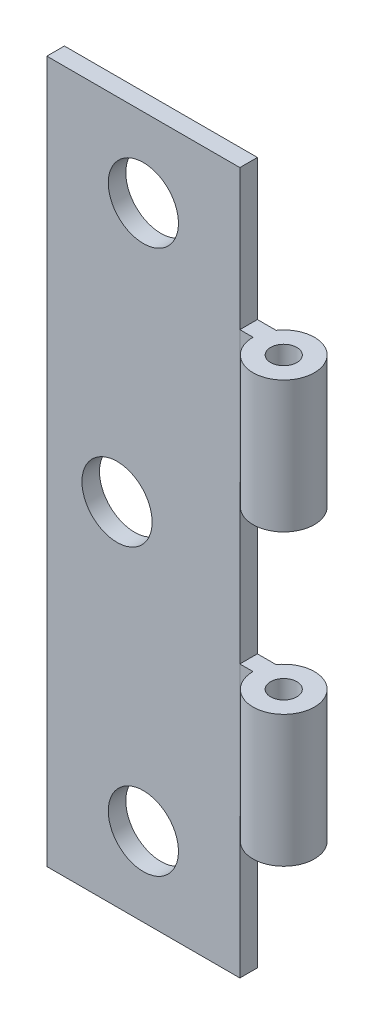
SolidWorks part; units mm, degrees
ref_plane "Front Plane" through (0, 0, 0) normal (0, 0, 1) x (1, 0, 0)
ref_plane "Top Plane" through (0, 0, 0) normal (0, 1, 0) x (1, 0, 0)
ref_plane "Right Plane" through (0, 0, 0) normal (1, 0, 0) x (0, 0, -1)
sketch "Sketch1" plane through (0, 0, 0) normal (0, 0, 1) x (1, 0, 0)
  line L1 (-8.7312, -31.75) -> (8.7313, -31.75)
  line L2 (-8.7312, -31.75) -> (-8.7312, 31.75)
  line L3 (-8.7312, 31.75) -> (8.7313, 31.75)
  line L4 (8.7313, -31.75) -> (8.7313, 31.75)
  line L5 (-8.7312, -31.75) -> (8.7313, 31.75) construction
  line L6 (-8.7312, 31.75) -> (8.7313, -31.75) construction
  point P0 (0, 0)
  dimension "D1" = 17.4625
  dimension "D2" = 63.5
extrude "Boss-Extrude1" add sketch "Sketch1" against normal blind 1.5875
sketch "Sketch3" plane through (0, 31.75, 0) normal (0, 1, 0) x (1, 0, 0)
  line L1 (8.7313, 0.7937) -> (24.4766, 0.7937) construction
  line L2 (8.7313, 0) -> (-8.7312, 0) construction
  line L4 (8.7313, 1.5875) -> (10.4201, 1.5875)
  line L5 (8.7313, 1.5875) -> (8.7313, 0)
  line L6 (8.7313, 0) -> (10.4201, 0)
  line L7 (10.4201, 1.5875) -> (10.4201, 0)
  circle A0 centre (12.7, 0) radius 1.1906
  circle A1 centre (12.7, 0) radius 2.7781
  point P1 (0, 0)
  point P2 (0, 0)
  point P7 (0, 0)
  dimension "D1" = 2.3813
  dimension "D2" = 5.5562
  dimension "D3" = 3.9688
extrude "Boss-Extrude2" add sketch "Sketch3" against normal up to surface (63.5 mm away) separate body contours L7 L1 A0 A1 L4 | L1 L7 A1 A0
sketch "Sketch4" plane through (0, 0, -1.5875) normal (0, 0, -1) x (-1, 0, 0)
  line L0 (2.3812, 31.75) -> (2.3813, -31.75) construction
  line L1 (-8.7313, 31.75) -> (8.7312, 31.75) construction
  line L2 (8.7312, -31.75) -> (-8.7313, -31.75) construction
  line L3 (0, -31.75) -> (0, 31.75) construction
  line L4 (8.7312, 31.75) -> (8.7312, -31.75) construction
  circle A0 centre (0, 24.6062) radius 3.175
  circle A1 centre (2.3812, 0) radius 3.175
  circle A2 centre (0, -24.6063) radius 3.175
  dimension "D1" = 6.35
  dimension "D2" = 6.35
  dimension "D3" = 8.7312
  dimension "D4" = 7.1437
  dimension "D5" = 7.1437
extrude "Cut-Extrude1" cut sketch "Sketch4" against normal through all
sketch "Sketch5" plane through (0, 0, -1.5875) normal (0, 0, -1) x (-1, 0, 0)
  line L0 (-8.7313, -31.75) -> (-8.7313, 31.75) construction
  line L1 (-8.7313, 19.05) -> (-15.4781, 19.05)
  line L2 (-8.7313, 19.05) -> (-8.7313, 7.1437)
  line L3 (-8.7313, 7.1437) -> (-15.4781, 7.1437)
  line L4 (-15.4781, 19.05) -> (-15.4781, 7.1437)
  line L5 (-15.4781, 31.75) -> (-15.4781, -31.75) construction
  line L6 (-8.7313, -31.75) -> (-8.7313, 31.75) construction
  line L7 (-8.7313, -7.1438) -> (-15.4781, -7.1438)
  line L8 (-8.7313, -7.1438) -> (-8.7313, -19.05)
  line L9 (-8.7313, -19.05) -> (-15.4781, -19.05)
  line L10 (-15.4781, -7.1438) -> (-15.4781, -19.05)
  line L11 (-15.4781, 19.8437) -> (-15.4781, 19.05)
  line L12 (-8.7313, 31.75) -> (-15.4781, 31.75)
  line L13 (-8.7313, 31.75) -> (-8.7313, 19.8437)
  line L14 (-8.7313, 19.8437) -> (-15.4781, 19.8437)
  line L15 (-15.4781, 31.75) -> (-15.4781, 19.8437)
  line L16 (-15.4781, 5.5562) -> (-8.7313, 5.5562)
  line L17 (-15.4781, 5.5562) -> (-15.4781, -6.35)
  line L18 (-15.4781, -6.35) -> (-8.7313, -6.35)
  line L19 (-8.7313, 5.5562) -> (-8.7313, -6.35)
  line L20 (-8.7313, -19.8438) -> (-15.4781, -19.8438)
  line L21 (-8.7313, -19.8438) -> (-8.7313, -31.75)
  line L22 (-8.7313, -31.75) -> (-15.4781, -31.75)
  line L23 (-15.4781, -19.8438) -> (-15.4781, -31.75)
  line L24 (-8.7313, 19.05) -> (-8.7313, 19.8437)
  line L25 (-8.7313, 7.1437) -> (-8.7313, 5.5562)
  line L26 (-15.4781, 5.5562) -> (-15.4781, 7.1437)
  line L27 (-15.4781, -6.35) -> (-15.4781, -7.1438)
  line L28 (-8.7313, -7.1438) -> (-8.7313, -6.35)
  line L29 (-8.7313, -19.05) -> (-8.7313, -19.8438)
  line L30 (-15.4781, -19.8438) -> (-15.4781, -19.05)
  dimension "D1" = 11.9062
  dimension "D2" = 11.9062
  dimension "D3" = 11.9062
  dimension "D4" = 11.9062
  dimension "D5" = 11.9062
  dimension "D6" = 0.7937
  dimension "D7" = 0.7937
  dimension "D8" = 0.7937
  dimension "D9" = 1.5875
extrude "Cut-Extrude3" cut sketch "Sketch5" against normal through all both and the other way through all contours L14 L11 L1 M17 | L26 L16 L3 M17 | L18 L27 L7 M17 | L30 L20 L9 M17 | L20 L23 L22 M17 | L17 L18 L16 M17 | L12 L15 L14 M17
